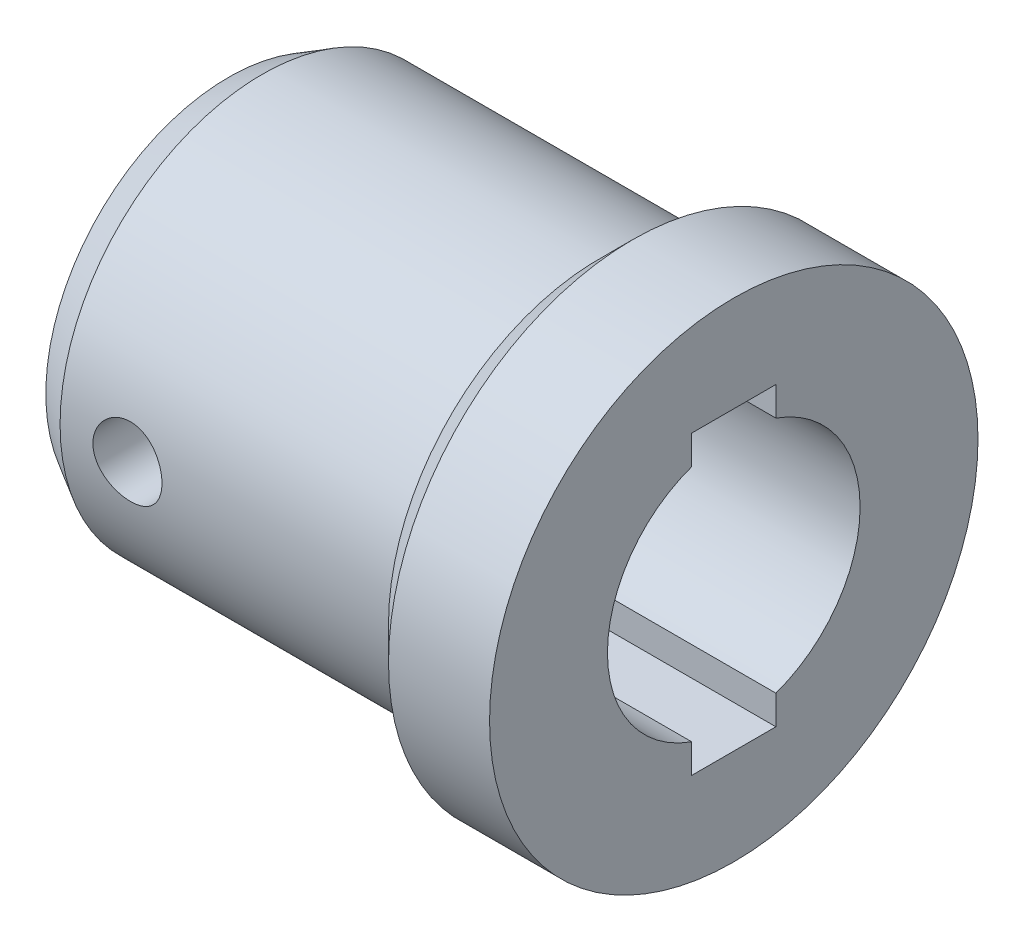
SolidWorks part; units mm, degrees
ref_plane "Face" through (0, 0, 0) normal (0, 0, 1) x (1, 0, 0)
ref_plane "Dessus" through (0, 0, 0) normal (0, 1, 0) x (1, 0, 0)
ref_plane "Droite" through (0, 0, 0) normal (1, 0, 0) x (0, 0, -1)
sketch "Esquisse1" plane through (0, 0, 0) normal (0, 0, 1) x (1, 0, 0)
  line L0 (0, 0) -> (61.8909, 0) construction
  line L1 (0, 7.5) -> (0, 12)
  line L2 (0, 7.5) -> (80.3, 7.5)
  line L3 (72.8, 10) -> (80.3, 10)
  line L4 (80.3, 10) -> (80.3, 7.5)
  line L5 (30, 14.5) -> (30, 12.5)
  line L6 (72.8, 10) -> (72.8, 9.4)
  line L7 (71.3, 11.5) -> (71.3, 9.4)
  line L8 (30, 12.5) -> (61.5, 12.5)
  line L9 (61.5, 12.5) -> (61.5, 11.5)
  line L10 (61.5, 11.5) -> (71.3, 11.5)
  line L11 (0, 12) -> (22, 12)
  line L12 (72.8, 9.4) -> (71.3, 9.4)
  line L13 (22, 12) -> (22, 14.5)
  line L15 (22, 14.5) -> (30, 14.5)
  dimension "D2" = 24
  dimension "D3" = 22
  dimension "D4" = 15
  dimension "D5" = 20
  dimension "D6" = 9.8
  dimension "D7" = 31.5
  dimension "D8" = 25
  dimension "D9" = 23
  dimension "D10" = 1.5
  dimension "D11" = 9
  dimension "D12" = 18.8
  dimension "D13" = 30
  dimension "D14" = 29
revolve "Révolution1" add sketch "Esquisse1" angle 360 about L0
chamfer "Chanfrein2" distance 0.5 angle 45 1 edges at (61.5, 0, 12.5)
chamfer "Chanfrein3" distance 2 angle 30 1 edges at (0, 0, 12)
sketch "Esquisse2" plane through (71.3, 0, 0) normal (1, 0, 0) x (0, 0, -1)
  line L0 (-5.3113, 10.2) -> (5.3113, 10.2)
  line L1 (-5.3113, -10.2) -> (5.3113, -10.2)
  arc A0 (-5.3113, -10.2) -> (5.3113, -10.2) centre (0, 0) ccw
  circle A1 centre (0, 0) radius 11.5
  arc A2 (5.3113, 10.2) -> (-5.3113, 10.2) centre (0, 0) ccw
  dimension "D2" = 10.2
  dimension "D3" = 10.2
  dimension "D1" = 0
extrude "Enlèv. mat.-Extru.1" cut sketch "Esquisse2" against normal up to surface (9.8 mm away)
fillet "Congé1" radius 3.5 4 edges at (66.4, 10.2, 5.3113) (66.4, 10.2, -5.3113) (66.4, -10.2, -5.3113) (66.4, -10.2, 5.3113)
chamfer "Chanfrein4" distance 2 angle 45 1 edges at (22, 0, 14.5)
sketch "Esquisse3" plane through (30, 0, 0) normal (1, 0, 0) x (0, 0, -1)
  circle A0 centre (0, 0) radius 12.5
  circle A1 centre (0, 0) radius 12.5 construction
extrude "Enlèv. mat.-Extru.2" cut sketch "Esquisse3" along normal through all
sketch "Esquisse4" plane through (30, 0, 0) normal (1, 0, 0) x (0, 0, -1)
  line L0 (0, 15.5407) -> (0, -15.2051) construction
  line L1 (16.044, 0) -> (-16.3376, 0) construction
  line L2 (2.5, -7.0711) -> (2.5, -8.8)
  line L3 (-2.5, 7.0711) -> (2.5, 7.0711)
  line L4 (-2.5, 7.0711) -> (-2.5, 8.8)
  line L5 (-2.5, 8.8) -> (2.5, 8.8)
  line L6 (2.5, 7.0711) -> (2.5, 8.8)
  line L7 (-2.5, -8.8) -> (2.5, -8.8)
  line L8 (-2.5, -7.0711) -> (-2.5, -8.8)
  line L9 (-2.5, -7.0711) -> (2.5, -7.0711)
  circle A0 centre (0, 0) radius 7.5 construction
  dimension "D1" = 1.3
  dimension "D2" = 5
extrude "Enlèv. mat.-Extru.3" cut sketch "Esquisse4" against normal through all
sketch "Esquisse5" plane through (0, 0, 0) normal (0, 0, 1) x (1, 0, 0)
  line L0 (0, 10.8453) -> (0, -10.8453) construction
  circle A0 centre (6, 0) radius 2.05
  dimension "D1" = 4.1
  dimension "D2" = 6
extrude "Enlèv. mat.-Extru.4" cut sketch "Esquisse5" along normal through all
